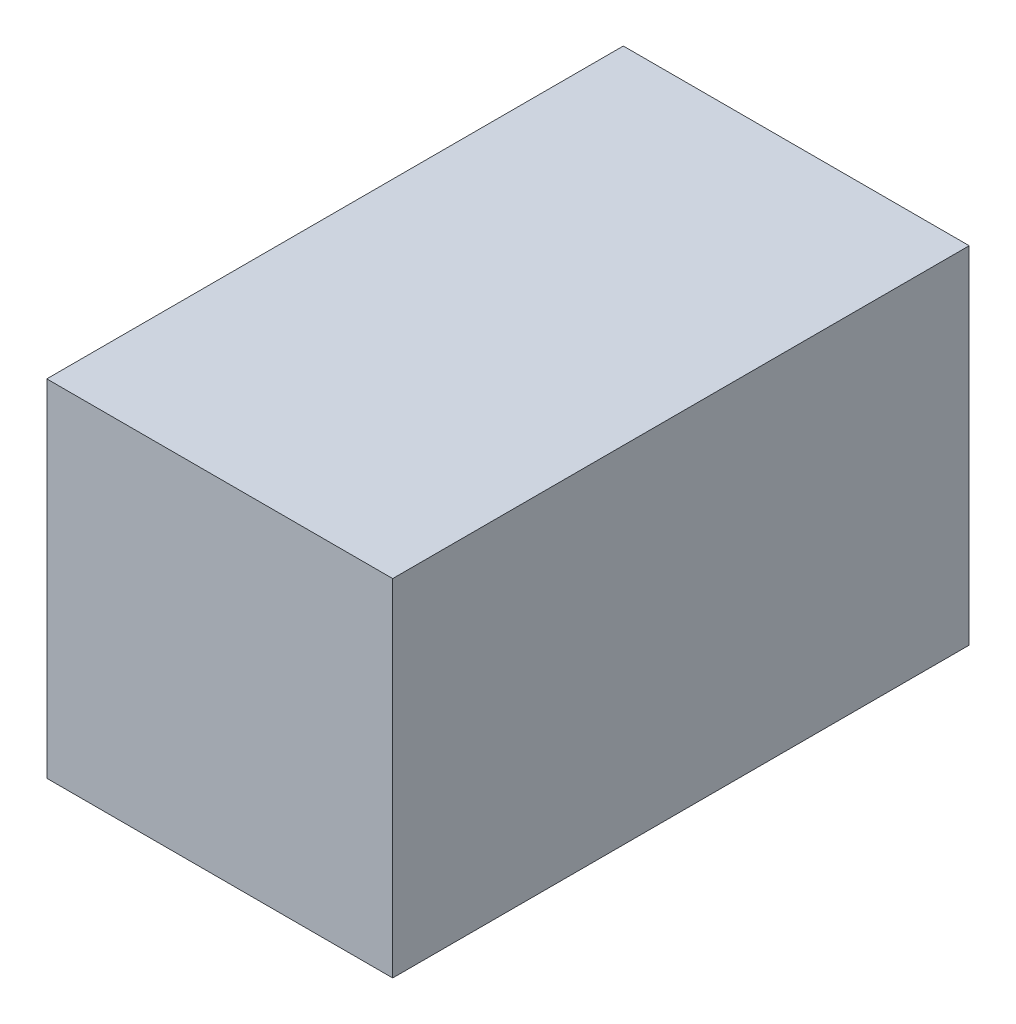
SolidWorks part; units mm, degrees
ref_plane "Plan de face" through (0, 0, 0) normal (0, 0, 1) x (1, 0, 0)
ref_plane "Plan de dessus" through (0, 0, 0) normal (0, 1, 0) x (1, 0, 0)
ref_plane "Plan de droite" through (0, 0, 0) normal (1, 0, 0) x (0, 0, -1)
sketch "Esquisse1" plane through (0, 0, 0) normal (0, 0, 1) x (1, 0, 0)
  line L1 (0, 0) -> (60, 0)
  line L2 (0, 0) -> (0, 60)
  line L3 (0, 60) -> (60, 60)
  line L4 (60, 0) -> (60, 60)
  dimension "D1" = 60
  dimension "D2" = 60
extrude "Extrusion1" add sketch "Esquisse1" along normal blind 100
